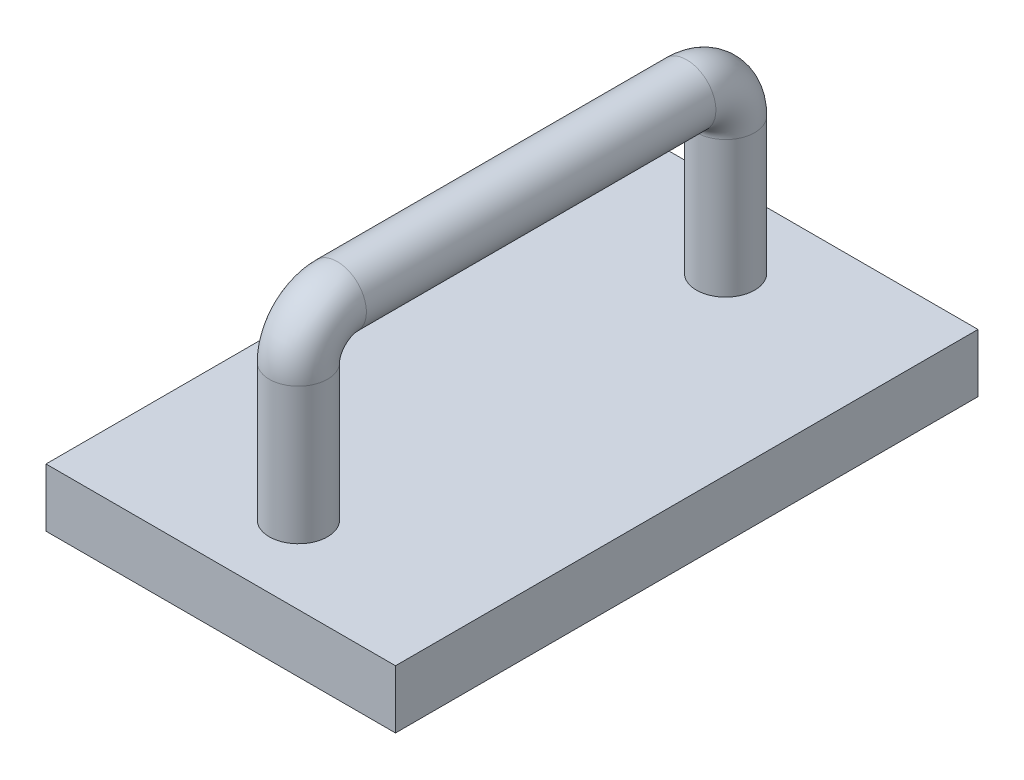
SolidWorks part; units mm, degrees
ref_plane "Alzado" through (0, 0, 0) normal (0, 0, 1) x (1, 0, 0)
ref_plane "Planta" through (0, 0, 0) normal (0, 1, 0) x (1, 0, 0)
ref_plane "Vista lateral" through (0, 0, 0) normal (1, 0, 0) x (0, 0, -1)
sketch "Croquis1" plane through (0, 0, 0) normal (0, 1, 0) x (1, 0, 0)
  line L0 (-45, 75) -> (45, -75) construction
  line L1 (-45, 75) -> (45, 75)
  line L2 (-45, 75) -> (-45, -75)
  line L3 (-45, -75) -> (45, -75)
  line L4 (45, 75) -> (45, -75)
  dimension "D1" = 90
  dimension "D2" = 150
extrude "Saliente-Extruir1" add sketch "Croquis1" along normal blind 15
ref_plane "Plano1" through (0, 0, 0) normal (-1, 0, 0) x (0, 0, 1)
sketch "Croquis2" plane through (0, 0, 0) normal (-1, 0, 0) x (0, 0, 1)
  line L0 (-55, 9.9933) -> (-55, 50.1365)
  line L1 (-45, 60.1365) -> (45, 60.1365)
  line L2 (55, 50.1365) -> (55, 9.9933)
  line L3 (75, 15) -> (75, 0) construction
  line L4 (-75, 15) -> (-75, 0) construction
  arc A0 (55, 50.1365) -> (45, 60.1365) centre (45, 50.1365) ccw
  arc A1 (-55, 50.1365) -> (-45, 60.1365) centre (-45, 50.1365) cw
  dimension "D3" = 10
  dimension "D1" = 20
  dimension "D2" = 20
sketch "Croquis3" plane through (0, 15, 0) normal (0, 1, 0) x (1, 0, 0)
  line L0 (45, 75) -> (-45, 75) construction
  line L1 (45, -75) -> (45, 75) construction
  circle A0 centre (0, 55) radius 7.5
  dimension "D3" = 15
  dimension "D1" = 20
  dimension "D2" = 45
sweep "Barrer1" add profiles "Croquis3" path "Croquis2"
